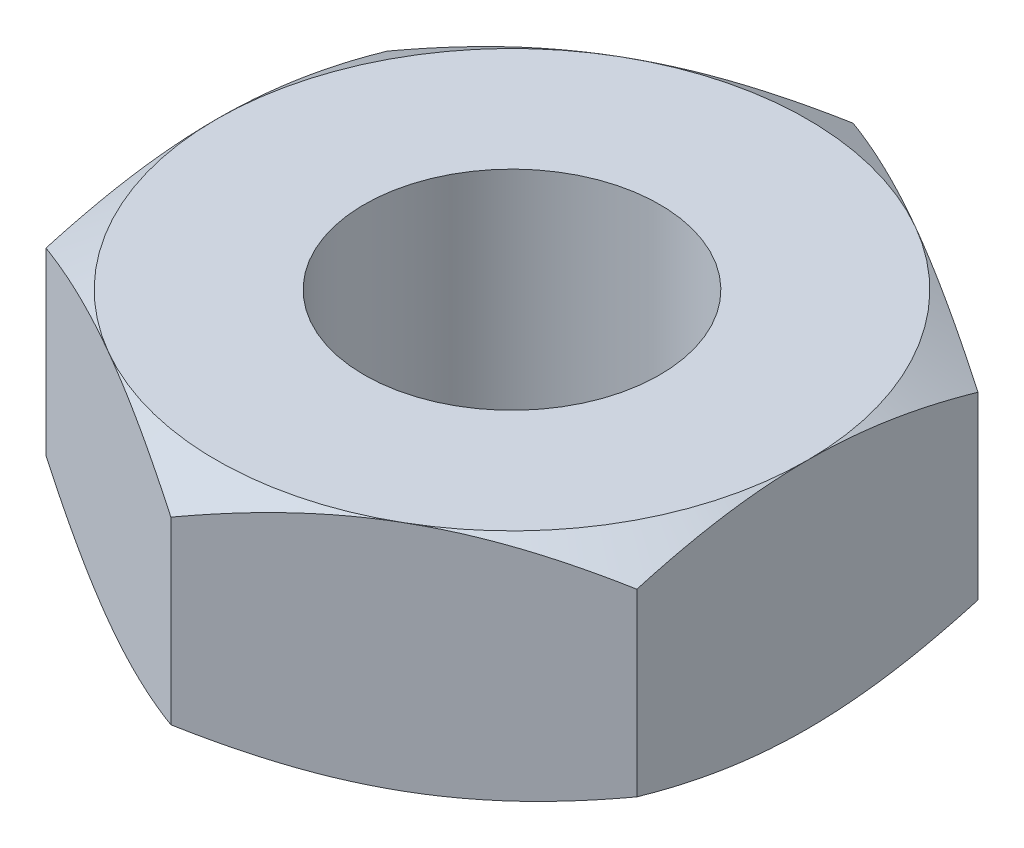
SolidWorks part; units mm, degrees
ref_plane "Front Plane" through (0, 0, 0) normal (0, 0, 1) x (1, 0, 0)
ref_plane "Top Plane" through (0, 0, 0) normal (0, 1, 0) x (1, 0, 0)
ref_plane "Right Plane" through (0, 0, 0) normal (1, 0, 0) x (0, 0, -1)
sketch "Sketch1" plane through (0, 0, 0) normal (0, 1, 0) x (1, 0, 0)
  line L1 (12.7, 7.3323) -> (0, 14.6647)
  line L2 (0, 14.6647) -> (-12.7, 7.3323)
  line L3 (-12.7, 7.3323) -> (-12.7, -7.3323)
  line L4 (-12.7, -7.3323) -> (0, -14.6647)
  line L5 (0, -14.6647) -> (12.7, -7.3323)
  line L6 (12.7, -7.3323) -> (12.7, 7.3323)
  circle A0 centre (0, 0) radius 12.7 construction
  dimension "D1" = 25.4
extrude "Boss-Extrude1" add sketch "Sketch1" along normal mid plane 10
sketch "Sketch2" plane through (0, 5, 0) normal (0, 1, 0) x (1, 0, 0)
  circle A0 centre (0, 0) radius 6.35
  dimension "D1" = 12.7
extrude "Cut-Extrude1" cut sketch "Sketch2" against normal through all
sketch "Sketch3" plane through (0, 5, 0) normal (0, 1, 0) x (1, 0, 0)
  circle A0 centre (0, 0) radius 12.7
extrude "Cut-Extrude2" cut sketch "Sketch3" against normal through all draft 60 flip side to cut
mirror "Mirror1" about plane through (0, 0, 0) normal (0, 1, 0) of "Cut-Extrude2"
